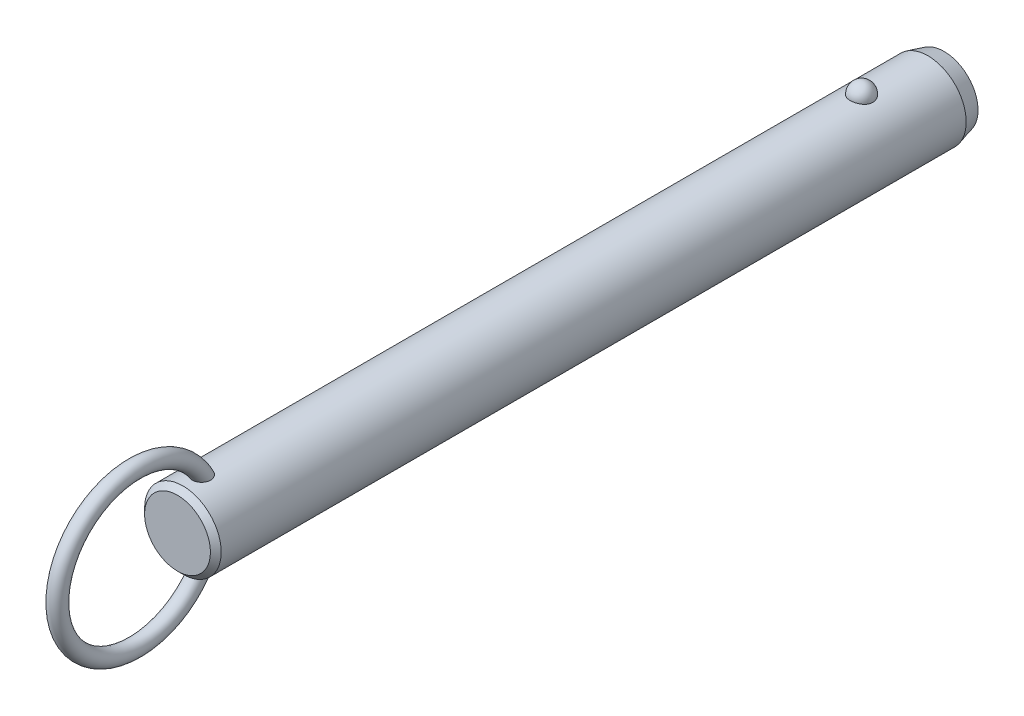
SolidWorks part; units mm, degrees
ref_plane "Front Plane" through (0, 0, 0) normal (0, 0, 1) x (1, 0, 0)
ref_plane "Top Plane" through (0, 0, 0) normal (0, 1, 0) x (1, 0, 0)
ref_plane "Right Plane" through (0, 0, 0) normal (1, 0, 0) x (0, 0, -1)
sketch "Sketch2" plane through (0, 0, 0) normal (0, 0, 1) x (1, 0, 0)
  circle A0 centre (0, 0) radius 7.1
  point P3 (0, 7.1)
  dimension "D1" = 14.2
extrude "Boss-Extrude1" add sketch "Sketch2" along normal blind 116.8
sketch "Sketch3" plane through (0, 0, 0) normal (0, 0, -1) x (-1, 0, 0)
  circle A0 centre (0, 0) radius 7.1
  dimension "D1" = 14.2
extrude "Boss-Extrude2" add sketch "Sketch3" along normal blind 17.4
chamfer "Chamfer1" distance 3 angle 15 1 edges at (-7.1, 0, -17.4)
sketch "Sketch12" plane through (0, 0, 0) normal (1, 0, 0) x (0, 0, -1)
  line L0 (-116.8, 7.1) -> (-116.8, -7.1) construction
  point P0 (-116.8, 0)
sketch "Sketch13" plane through (0, 0, 0) normal (1, 0, 0) x (0, 0, -1)
  circle A0 centre (-132.65, 0) radius 15.85
  point P2 (-116.8, 0)
  dimension "D1" = 31.7
sketch "Sketch14" plane through (0, 0, 0) normal (0, 1, 0) x (1, 0, 0)
  circle A0 centre (0, -118.3) radius 1.5
  point P2 (0, -116.8)
  dimension "D1" = 3
sweep "Sweep1" add profiles "Sketch14" path "Sketch13"
sketch "Sketch15" plane through (0, 0, 116.8) normal (0, 0, 1) x (1, 0, 0)
  circle A0 centre (0, 0) radius 7.1
  dimension "D1" = 14.2
extrude "Boss-Extrude3" add sketch "Sketch15" along normal blind 7.92
chamfer "Chamfer2" distance 1 angle 45 1 edges at (7.1, 0, 124.72)
sketch "Sketch18" plane through (0, 0, 0) normal (1, 0, 0) x (0, 0, -1)
  line L0 (14.4, 7.1) -> (-118.4792, 7.1) construction
  line L1 (2.1, 9.2) -> (2.1, 5)
  line L2 (-118.4792, -7.1) -> (14.4, -7.1) construction
  arc A0 (2.1, 9.2) -> (2.1, 5) centre (2.1, 7.1) ccw
  point P4 (0, 7.1)
  dimension "D1" = 16.3
revolve "Revolve1" add sketch "Sketch18" angle 360 about L1
